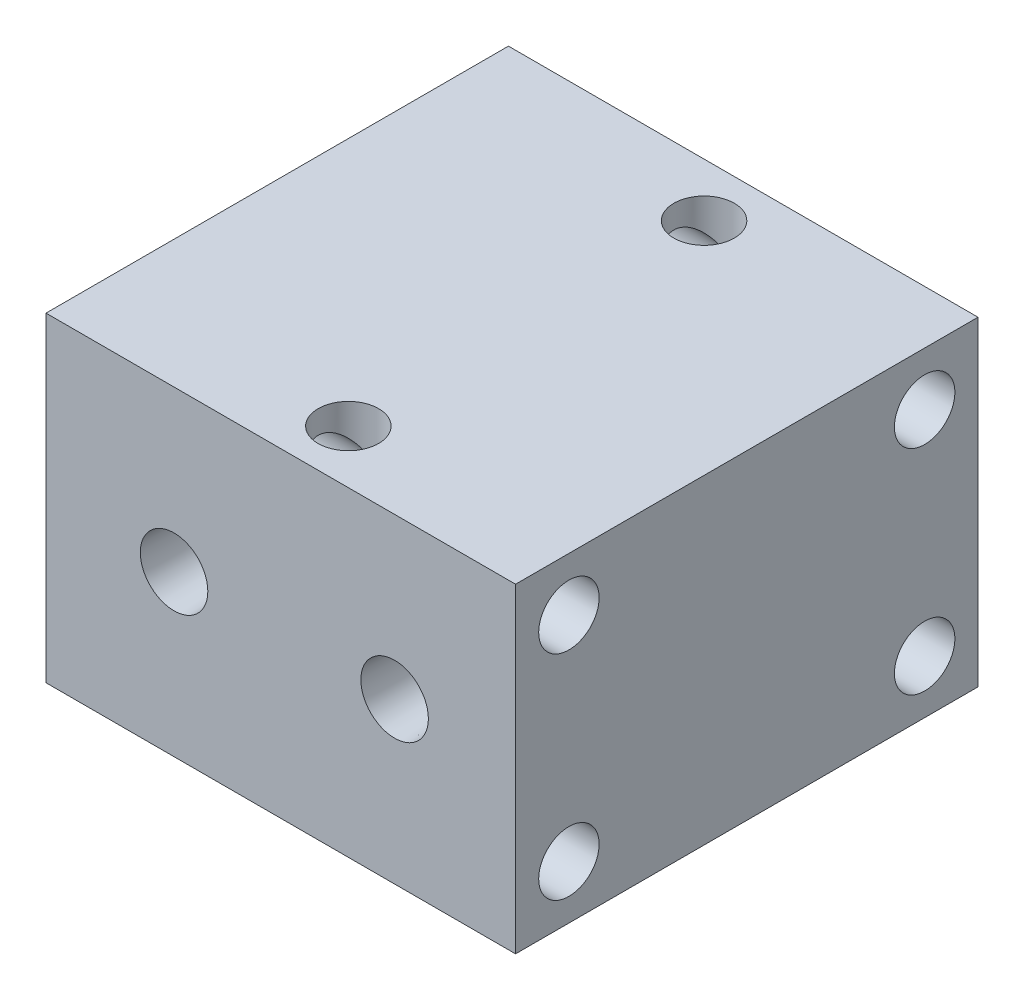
SolidWorks part; units mm, degrees
ref_plane "Front Plane" through (0, 0, 0) normal (0, 0, 1) x (1, 0, 0)
ref_plane "Top Plane" through (0, 0, 0) normal (0, 1, 0) x (1, 0, 0)
ref_plane "Right Plane" through (0, 0, 0) normal (1, 0, 0) x (0, 0, -1)
sketch "Sketch1" plane through (0, 0, 0) normal (0, 1, 0) x (1, 0, 0)
  line L0 (2, 25) -> (2, -25) construction
  line L1 (-33, 32.5) -> (33, 32.5)
  line L2 (-33, 32.5) -> (-33, -32.5)
  line L3 (-33, -32.5) -> (33, -32.5)
  line L4 (33, 32.5) -> (33, -32.5)
  line L5 (-33, 0) -> (2, 0) construction
  circle A0 centre (2, 25) radius 4.25
  circle A1 centre (2, -25) radius 4.25
  dimension "D5" = 8.5
  dimension "D6" = 8.5
  dimension "D8" = 35
  dimension "D1" = 65
  dimension "D2" = 32.5
  dimension "D3" = 66
  dimension "D4" = 33
  dimension "D7" = 50
extrude "Extrude1" add sketch "Sketch1" along normal blind 45
sketch "Sketch2" plane through (-33, 0, 0) normal (-1, 0, 0) x (0, 0, 1)
  line L0 (0, 0) -> (0, 22.5) construction
  line L1 (32.5, 22.5) -> (0, 22.5) construction
  line L2 (32.5, 45) -> (32.5, 0) construction
  circle A0 centre (0, 22.5) radius 0.5
  dimension "D1" = 1
extrude "Cut-Extrude1" cut sketch "Sketch2" against normal blind 60
hole_wizard "1/8 NPT Tapped Hole1" positions "Sketch4" profile "Sketch3" size "1/8" standard "Ansi Inch"
sketch "Sketch4" plane through (0, 0, 32.5) normal (0, 0, 1) x (1, 0, 0)
  line L0 (-33, 22.5) -> (33, 22.5) construction
  line L1 (-33, 45) -> (-33, 0) construction
  line L2 (33, 45) -> (33, 0) construction
  point P0 (16, 22.5)
  point P1 (-15, 22.5)
  dimension "D1" = 18
  dimension "D2" = 17
sketch "Sketch3" plane through (16, 22.5, 32.5) normal (1, 0, 0) x (0, -1, 0)
  line L0 (0, 0) -> (0, 14.1535)
  line L1 (4.2164, 11.62) -> (0, 14.1535)
  line L2 (-4.2164, 11.62) -> (0, 14.1535) construction
  line L3 (4.2164, 11.62) -> (4.2164, 6.92)
  line L4 (4.2164, 6.92) -> (4.5374, 6.92)
  line L5 (4.5374, 6.92) -> (4.7446, 0)
  line L6 (-4.5374, 6.92) -> (-4.7446, 0) construction
  line L7 (4.7446, 0) -> (0, 0)
  line L8 (0, -6.35) -> (0, 107.95) construction
  line L11 (-4.2164, 6.92) -> (-4.5374, 6.92) construction
  dimension "Tap Drill Dia." = 8.4328
  dimension "Tap Drill Depth" = 11.62
  dimension "Thread Dia." = 9.4892
  dimension "Thread Angle" = 3.43
  dimension "Thread Depth" = 6.92
  dimension "Drill Angle" = 118
sketch "Sketch5" plane through (0, 0, 32.5) normal (0, 0, 1) x (1, 0, 0)
  circle A0 centre (-15, 22.5) radius 2
  circle A1 centre (16, 22.5) radius 2
  circle A2 centre (16, 22.5) radius 4.7446 construction
  circle A3 centre (-15, 22.5) radius 4.7446 construction
  dimension "D1" = 4
  dimension "D2" = 4
extrude "Cut-Extrude2" cut sketch "Sketch5" against normal blind 20
sketch "Sketch6" plane through (-33, 0, 0) normal (-1, 0, 0) x (0, 0, 1)
  line L0 (-25, 45) -> (-25, 0) construction
  line L1 (25, 45) -> (25, 0) construction
  line L3 (-25, 37.5) -> (25, 37.5) construction
  line L5 (-25, 7.5) -> (25, 7.5) construction
  circle A0 centre (-25, 37.5) radius 4.25
  circle A1 centre (-25, 7.5) radius 4.25
  circle A2 centre (25, 37.5) radius 4.25
  circle A3 centre (25, 7.5) radius 4.25
  dimension "D3" = 8.5
  dimension "D1" = 15
  dimension "D2" = 30
extrude "Cut-Extrude3" cut sketch "Sketch6" against normal up to surface (66 mm away)
equation "\"D1@Sketch6\" = \"D2@Sketch6\" / 2"
equation "\"D5@Sketch1\" = \"D6@Sketch1\""
equation "\"D2@Sketch1\" = \"D1@Sketch1\"/2"
equation "\"D4@Sketch1\"=\"D3@Sketch1\" / 2"
